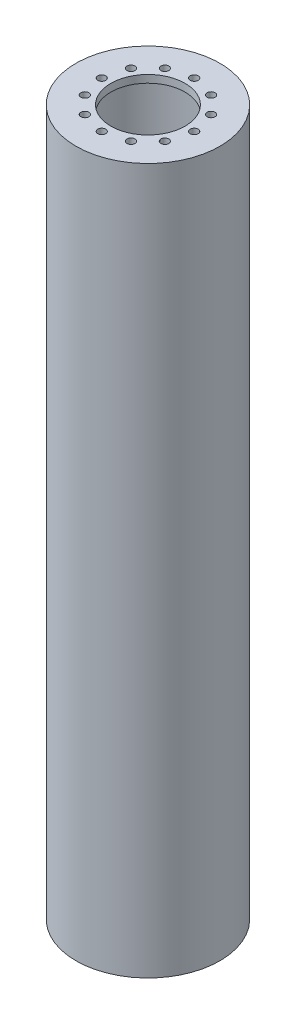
SolidWorks part; units mm, degrees
ref_plane "Alzado" through (0, 0, 0) normal (0, 0, 1) x (1, 0, 0)
ref_plane "Planta" through (0, 0, 0) normal (0, 1, 0) x (1, 0, 0)
ref_plane "Vista lateral" through (0, 0, 0) normal (1, 0, 0) x (0, 0, -1)
sketch "Croquis1" plane through (0, 0, 0) normal (0, 0, 1) x (1, 0, 0)
  line L0 (0, 1016.2855) -> (0, -76.1235) construction
  line L1 (0, -76.1235) -> (95, -76.1235)
  line L2 (95, -76.1235) -> (95, 855.0765)
  line L3 (85, 845.0765) -> (49, 845.0765)
  line L4 (49, 845.0765) -> (49, 855.0765)
  line L5 (49, 855.0765) -> (95, 855.0765)
  line L6 (85, 845.0765) -> (85, -66.1235)
  line L7 (85, -66.1235) -> (0, -66.1235)
  line L8 (0, -66.1235) -> (0, -76.1235)
  dimension "D1" = 931.2
  dimension "D2" = 10
  dimension "D3" = 911.2
  dimension "D4" = 95
  dimension "D5" = 10
  dimension "D6" = 49
revolve "Revolución1" add sketch "Croquis1" angle 360 about L0
sketch "Croquis4" plane through (0, 855.0765, 0) normal (0, 1, 0) x (1, 0, 0)
  circle A0 centre (0, 61) radius 5.25
  dimension "D1" = 10.5
  dimension "D2" = 61
extrude "Cortar-Extruir2" cut sketch "Croquis4" against normal up to surface (10 mm away)
pattern_circular "MatrizC9" count 12 over 360 about axis through (0, 0, 0) along (0, 1, 0) of "Cortar-Extruir2"
